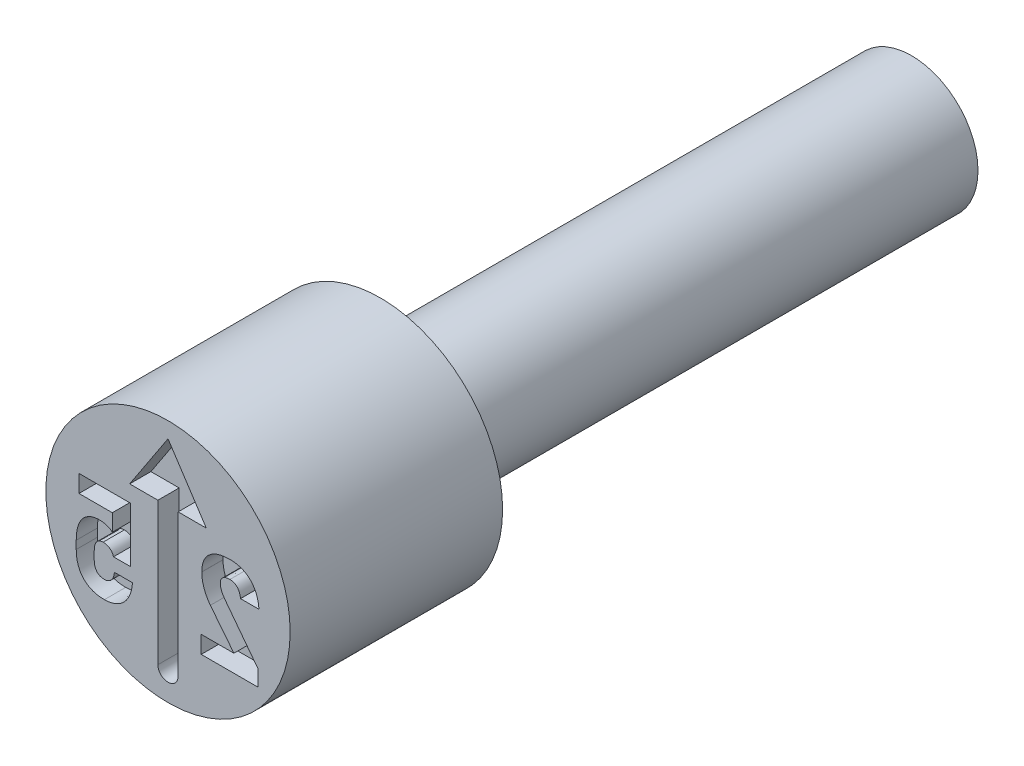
SolidWorks part; units mm, degrees
ref_plane "Front Plane" through (0, 0, 0) normal (0, 0, 1) x (1, 0, 0)
ref_plane "Top Plane" through (0, 0, 0) normal (0, 1, 0) x (1, 0, 0)
ref_plane "Right Plane" through (0, 0, 0) normal (1, 0, 0) x (0, 0, -1)
sketch "Sketch2" plane through (0, 0, 0) normal (1, 0, 0) x (0, 0, -1)
  line L0 (0.4039, 0) -> (50000.4039, 0) construction
  line L6 (0, 2.3) -> (0, 0)
  line L7 (4, 2.3) -> (0, 2.3)
  line L8 (4, 1.25) -> (4, 2.3)
  line L9 (14, 1.25) -> (4, 1.25)
  line L10 (14, 0) -> (14, 1.25)
  line L11 (0, 0) -> (14, 0)
  dimension "D1" = 4.6
  dimension "D2" = 2.5
  dimension "D3" = 14
  dimension "D4" = 4
revolve "Revolve1" add sketch "Sketch2" angle 360 about L0
sketch "Sketch3" plane through (0, 0, 0) normal (0, 0, 1) x (1, 0, 0)
  line L0 (0, 0) -> (0, 100000) construction
  line L1 (0.1905, 0.9064) -> (0.1905, -1.7762)
  line L2 (0.7219, 0.9064) -> (0.1905, 0.9064)
  line L3 (0, 2.0021) -> (0.7219, 0.9064)
  line L15 (0, 2.0021) -> (-0.7219, 0.9064)
  line L16 (-0.7219, 0.9064) -> (-0.1905, 0.9064)
  line L17 (-0.1905, 0.9064) -> (-0.1905, -1.7762)
  arc A2 (-0.1905, -1.7762) -> (0.1905, -1.7762) centre (0, -1.7762) ccw
extrude "Cut-Extrude4" cut sketch "Sketch3" against normal blind 0.4
sketch "Sketch4" plane through (0, 0, 0) normal (0, 0, 1) x (1, 0, 0)
  text T0 "2  5" font "Bahnschrift" height 1.8
  dimension "D1" = 1.2
extrude "Cut-Extrude5" cut sketch "Sketch4" against normal blind 0.4
